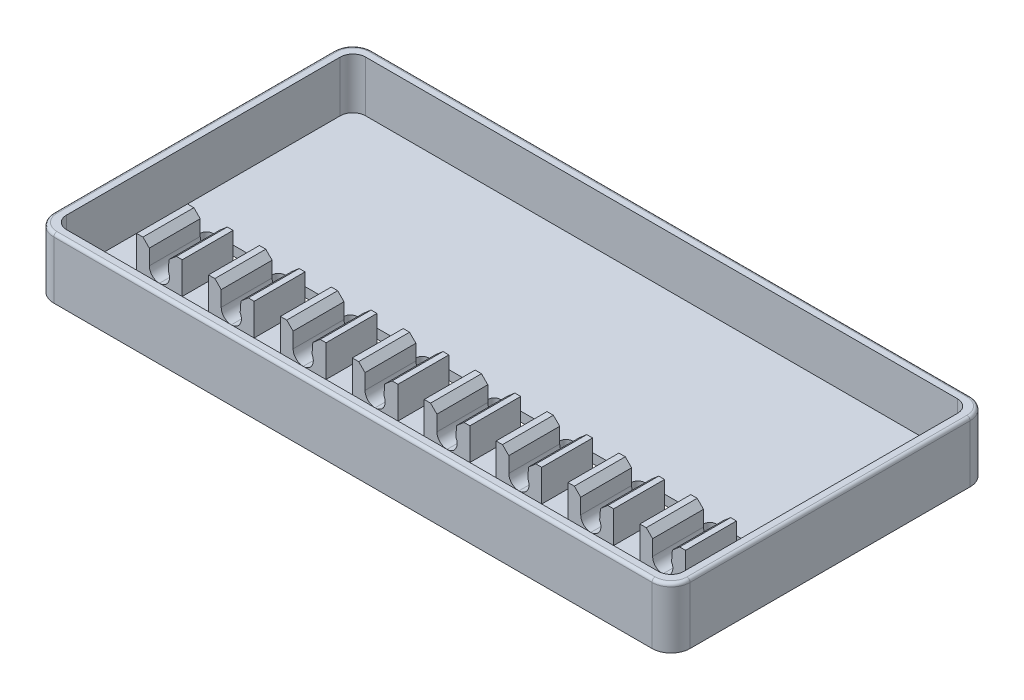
SolidWorks part; units mm, degrees
ref_plane "Front Plane" through (0, 0, 0) normal (0, 0, 1) x (1, 0, 0)
ref_plane "Top Plane" through (0, 0, 0) normal (0, 1, 0) x (1, 0, 0)
ref_plane "Right Plane" through (0, 0, 0) normal (1, 0, 0) x (0, 0, -1)
sketch "Sketch1" plane through (0, 0, 0) normal (0, 1, 0) x (1, 0, 0)
  line L1 (0, 0) -> (100, 0)
  line L2 (0, 0) -> (0, 50)
  line L3 (0, 50) -> (100, 50)
  line L4 (100, 0) -> (100, 50)
  dimension "D1" = 100
  dimension "D2" = 50
extrude "Boss-Extrude1" add sketch "Sketch1" along normal blind 1.5
sketch "Sketch3" plane through (0, 1.5, 0) normal (0, 1, 0) x (1, 0, 0)
  line L0 (0, 0) -> (100, 50) construction
  line L1 (0, 50) -> (0, 0) construction
  line L2 (1.5, 48.5) -> (98.5, 48.5)
  line L3 (1.5, 48.5) -> (1.5, 1.5)
  line L4 (1.5, 1.5) -> (98.5, 1.5)
  line L5 (98.5, 48.5) -> (98.5, 1.5)
  line L6 (0, 0) -> (100, 0) construction
  line L7 (100, 50) -> (0, 50) construction
  line L8 (100, 0) -> (100, 50) construction
  line L10 (0, 50) -> (100, 50)
  line L11 (0, 50) -> (0, 0)
  line L12 (0, 0) -> (100, 0)
  line L13 (100, 50) -> (100, 0)
  dimension "D1" = 1.5
  dimension "D2" = 1.5
  dimension "D3" = 1.5
  dimension "D4" = 1.5
extrude "Boss-Extrude4" add sketch "Sketch3" along normal blind 8 contours L11 L12 L13 L10
sketch "Sketch4" plane through (0, 1.5, 0) normal (0, 1, 0) x (1, 0, 0)
  line L0 (1.5, 1.5) -> (98.5, 1.5) construction
  line L1 (6.5, 17.5) -> (8.5, 17.5)
  line L2 (6.5, 17.5) -> (6.5, 9.5)
  line L3 (6.5, 9.5) -> (8.5, 9.5)
  line L4 (8.5, 17.5) -> (8.5, 9.5)
  line L5 (1.5, 48.5) -> (1.5, 1.5) construction
  line L6 (11.675, 17.5) -> (13.675, 17.5)
  line L7 (11.675, 17.5) -> (11.675, 9.5)
  line L8 (11.675, 9.5) -> (13.675, 9.5)
  line L9 (13.675, 17.5) -> (13.675, 9.5)
  dimension "D1" = 8
  dimension "D2" = 8
  dimension "D3" = 2
  dimension "D4" = 2
  dimension "D5" = 3.175
  dimension "D6" = 8
  dimension "D7" = 8
  dimension "D8" = 5
extrude "Boss-Extrude5" add sketch "Sketch4" along normal blind 5
fillet "Fillet1" radius 1.5875 2 edges at (11.675, 1.5, -13.5) (8.5, 1.5, -13.5)
sketch "Sketch5" plane through (0, 0, -9.5) normal (0, 0, 1) x (1, 0, 0)
  line L0 (11.675, 6.5) -> (11.475, 3.8589)
  line L6 (10.0875, 1.5) -> (13.675, 1.5)
  line L7 (13.675, 1.5) -> (13.675, 6.5)
  line L8 (13.675, 6.5) -> (11.675, 6.5)
  line L9 (11.675, 6.5) -> (11.675, 3.0875)
  line L13 (11.675, 6.5) -> (11.675, 3.0875)
  arc A0 (11.675, 3.0875) -> (11.475, 3.8589) centre (10.0875, 3.0875) ccw
  arc A2 (10.0875, 1.5) -> (11.675, 3.0875) centre (10.0875, 3.0875) ccw
  dimension "D1" = 1.5875
  dimension "D3" = 0.2
  dimension "D2" = 0
extrude "Boss-Extrude6" add sketch "Sketch5" against normal up to surface (8 mm away)
chamfer "Chamfer1" distance 1 angle 45 2 edges at (8.5, 6.5, -13.5) (11.675, 6.5, -13.5)
sketch "Sketch6" plane through (0, 1.5, 0) normal (0, 1, 0) x (1, 0, 0)
  line L0 (6.5, 17.5) -> (13.675, 17.5)
  line L1 (13.675, 17.5) -> (13.675, 20.5)
  line L2 (13.675, 20.5) -> (6.5, 20.5)
  line L3 (6.5, 20.5) -> (6.5, 17.5)
  dimension "D1" = 3
extrude "Cut-Extrude1" cut sketch "Sketch6" against normal up to surface (1.5 mm away)
fillet "Fillet2" radius 1 2 edges at (13.675, 0.75, -20.5) (6.5, 0.75, -20.5)
pattern_linear "LPattern1" count 8 spacing 11.3 along (1, 0, 0) of "Boss-Extrude5", "Fillet1", "Boss-Extrude6", "Chamfer1", "Cut-Extrude1", "Fillet2"
fillet "Fillet5" radius 0.5 4 edges at (50, 9.5, 0) (0, 9.5, -25) (100, 9.5, -25) (50, 9.5, -50)
fillet "Fillet6" radius 2 4 edges at (98.5, 5.5, -1.5) (98.5, 5.5, -48.5) (1.5, 5.5, -1.5) (1.5, 5.5, -48.5)
fillet "Fillet7" radius 3 8 edges at (99.8536, 9.3536, -0.1464) (99.8536, 9.3536, -49.8536) (0.1464, 9.3536, -49.8536) (0.1464, 9.3536, -0.1464) (0, 4.5, 0) (0, 4.5, -50) (100, 4.5, -50) (100, 4.5, 0)
equation "\"D2@Sketch3\"=\"D1@Sketch3\""
equation "\"D3@Sketch3\"=\"D2@Sketch3\""
equation "\"D4@Sketch3\"=\"D1@Sketch3\""
equation "\"D4@Sketch4\"=\"D3@Sketch4\""
equation "\"D6@Sketch4\"=\"D2@Sketch4\""
equation "\"D7@Sketch4\"=\"D1@Sketch4\""
